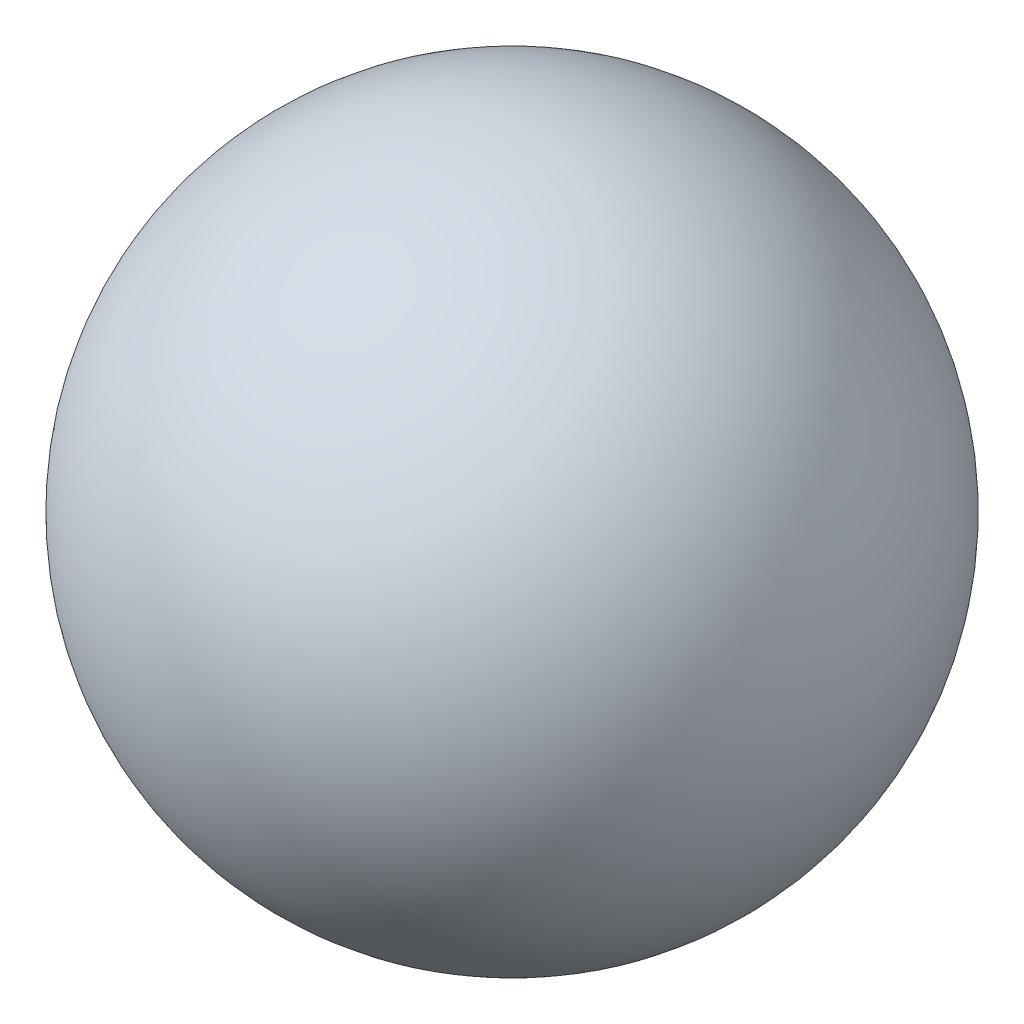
SolidWorks part; units mm, degrees
ref_plane "Plan de face" through (0, 0, 0) normal (0, 0, 1) x (1, 0, 0)
ref_plane "Plan de dessus" through (0, 0, 0) normal (0, 1, 0) x (1, 0, 0)
ref_plane "Plan de droite" through (0, 0, 0) normal (1, 0, 0) x (0, 0, -1)
sketch "Esquisse1" plane through (0, 0, 0) normal (0, 0, 1) x (1, 0, 0)
  line L0 (0, 58.1303) -> (0, -49.9167) construction
  line L1 (0, 13.5) -> (0, -13.5)
  arc A0 (0, 13.5) -> (0, -13.5) centre (0, 0) ccw
  dimension "D1" = 13.5
revolve "Révolution1" add sketch "Esquisse1" angle 360 about L0
